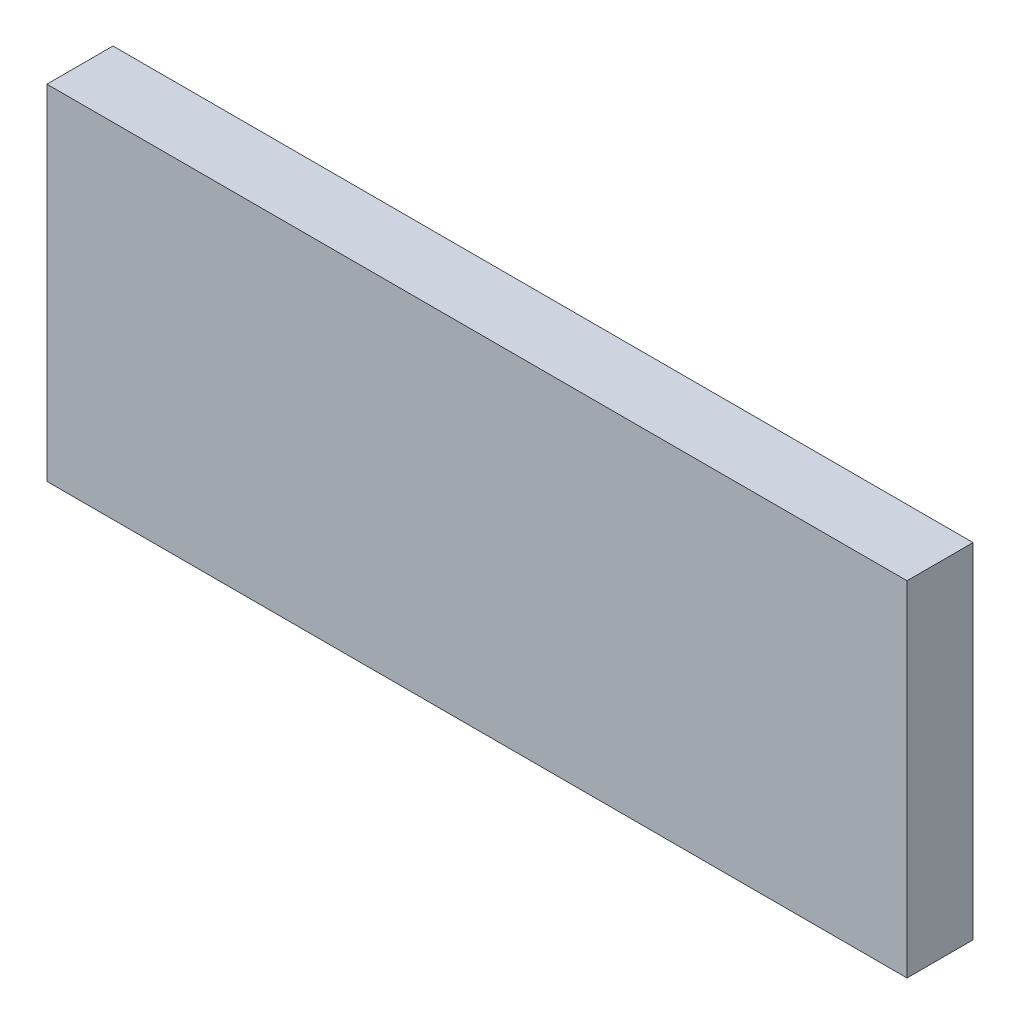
SolidWorks part; units mm, degrees
ref_plane "Front Plane" through (0, 0, 0) normal (0, 0, 1) x (1, 0, 0)
ref_plane "Top Plane" through (0, 0, 0) normal (0, 1, 0) x (1, 0, 0)
ref_plane "Right Plane" through (0, 0, 0) normal (1, 0, 0) x (0, 0, -1)
sketch "Sketch1" plane through (0, 0, 0) normal (0, 0, 1) x (1, 0, 0)
  line L1 (-7.9375, 3.175) -> (7.9375, 3.175)
  line L2 (-7.9375, 3.175) -> (-7.9375, -3.175)
  line L3 (-7.9375, -3.175) -> (7.9375, -3.175)
  line L4 (7.9375, 3.175) -> (7.9375, -3.175)
  line L5 (-7.9375, 3.175) -> (7.9375, -3.175) construction
  line L6 (-7.9375, -3.175) -> (7.9375, 3.175) construction
  point P0 (0, 0)
  dimension "D1" = 6.35
  dimension "D2" = 15.875
base flange "Base-Flange1" sketch "Sketch1" thickness 1.2192 reverse thickness direction no parameters "D1"=0.7366
sketch "Bend-Lines1" [suppressed] plane through (0, 0, 0) normal (0, 1, 0) x (1, 0, 0)
sketch "Bounding-Box1" [suppressed] plane through (0, 0, 0) normal (0, 1, 0) x (1, 0, 0)
sheet metal parameters "Sheet-Metal1" thickness 1.2192 parameters "D1"=0.7366
flat pattern "Flat-Pattern1"
sketch "Bend-Lines2" plane through (0, 0, 0) normal (0, 1, 0) x (1, 0, 0)
sketch3d "Bounding-Box2" [suppressed]
  line L0 (-7.9375, -3.175, 0) -> (7.9375, -3.175, 0) construction
  line L1 (-7.9375, 3.175, 0) -> (7.9375, 3.175, 0) construction
  line L2 (-7.9375, -3.175, 0) -> (-7.9375, 3.175, 0) construction
  line L3 (7.9375, -3.175, 0) -> (7.9375, 3.175, 0) construction
